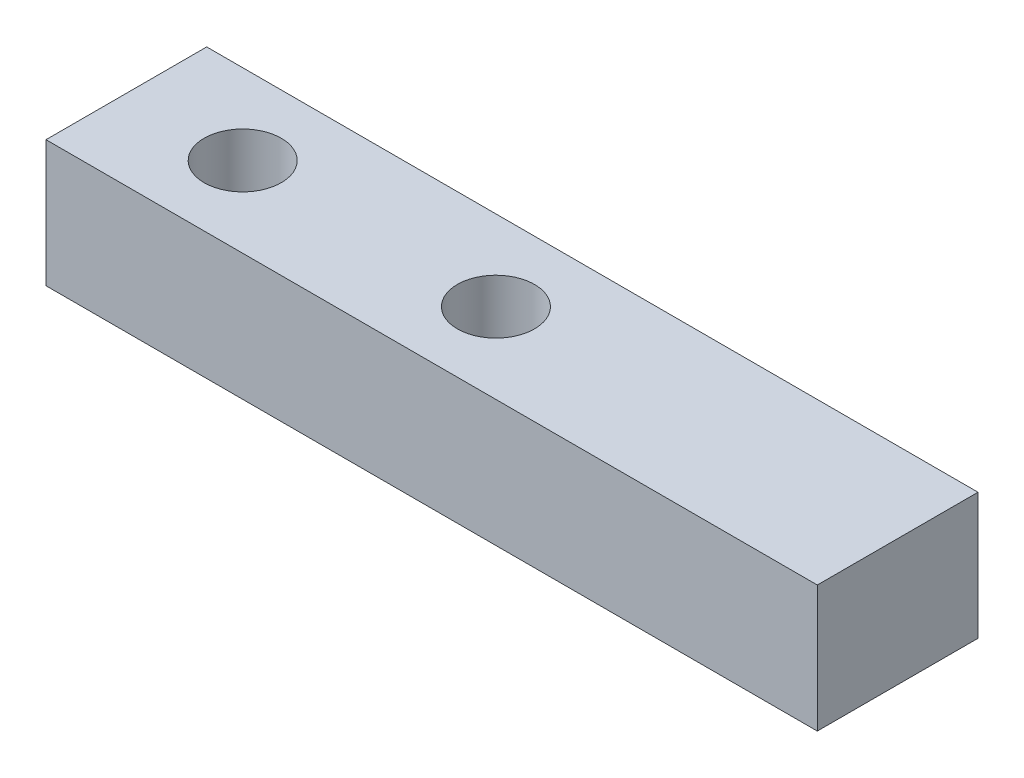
SolidWorks part; units mm, degrees
ref_plane "Front Plane" through (0, 0, 0) normal (0, 0, 1) x (1, 0, 0)
ref_plane "Top Plane" through (0, 0, 0) normal (0, 1, 0) x (1, 0, 0)
ref_plane "Right Plane" through (0, 0, 0) normal (1, 0, 0) x (0, 0, -1)
sketch "Sketch1" plane through (0, 0, 0) normal (1, 0, 0) x (0, 0, -1)
  line L1 (-3.175, 2.5) -> (3.175, 2.5)
  line L2 (-3.175, 2.5) -> (-3.175, -2.5)
  line L3 (-3.175, -2.5) -> (3.175, -2.5)
  line L4 (3.175, 2.5) -> (3.175, -2.5)
  line L5 (-3.175, 2.5) -> (3.175, -2.5) construction
  line L6 (-3.175, -2.5) -> (3.175, 2.5) construction
  point P0 (0, 0)
  dimension "D1" = 6.35
  dimension "D2" = 5
extrude "Boss-Extrude1" add sketch "Sketch1" along normal blind 30.48
sketch "Sketch2" plane through (0, 2.5, 0) normal (0, 1, 0) x (1, 0, 0)
  line L1 (30.48, 3.175) -> (0, 3.175) construction
  line L2 (0, 3.175) -> (0, -3.175) construction
  circle A0 centre (4.5974, 0) radius 1.524
  circle A1 centre (14.605, 0) radius 1.524
  dimension "D1" = 3.048
  dimension "D2" = 3.175
  dimension "D3" = 4.5974
  dimension "D4" = 10.0076
extrude "Cut-Extrude1" cut sketch "Sketch2" against normal up to next contours A1 | A0
